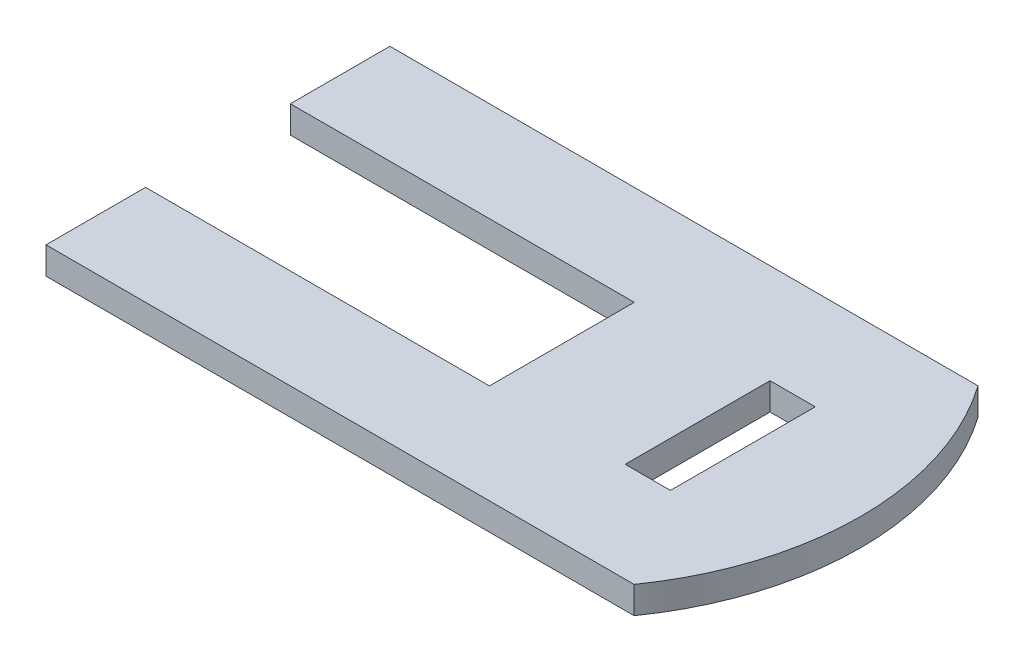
SolidWorks part; units mm, degrees
ref_plane "Front" through (0, 0, 0) normal (0, 0, 1) x (1, 0, 0)
ref_plane "Top" through (0, 0, 0) normal (0, 1, 0) x (1, 0, 0)
ref_plane "Right" through (0, 0, 0) normal (1, 0, 0) x (0, 0, -1)
sketch "Sketch1" plane through (0, 0, 0) normal (0, 1, 0) x (1, 0, 0)
  line L0 (0, 27) -> (38, 27)
  line L1 (0, 0) -> (64.9815, 0)
  line L2 (0, 0) -> (0, 11)
  line L3 (0, 38) -> (64.9815, 38)
  line L5 (0, 11) -> (38, 11)
  line L7 (38, 11) -> (38, 27)
  line L8 (53, 11) -> (53, 27)
  line L9 (58, 11) -> (58, 27)
  line L10 (0, 38) -> (71, 38) construction
  line L11 (0, 0) -> (71, 0) construction
  line L12 (53, 0) -> (53, 38) construction
  line L13 (58, 0) -> (58, 38) construction
  line L15 (0, 27) -> (71, 27) construction
  line L18 (0, 11) -> (71, 11) construction
  line L19 (53, 11) -> (58, 11)
  line L21 (53, 27) -> (58, 27)
  line L22 (0, 27) -> (0, 38)
  line L23 (0, 0) -> (0, 38) construction
  line L24 (38, 0) -> (38, 38) construction
  arc A1 (64.9815, 0) -> (64.9815, 38) centre (38, 19) ccw
extrude "Extrude1" add sketch "Sketch1" along normal blind 3
